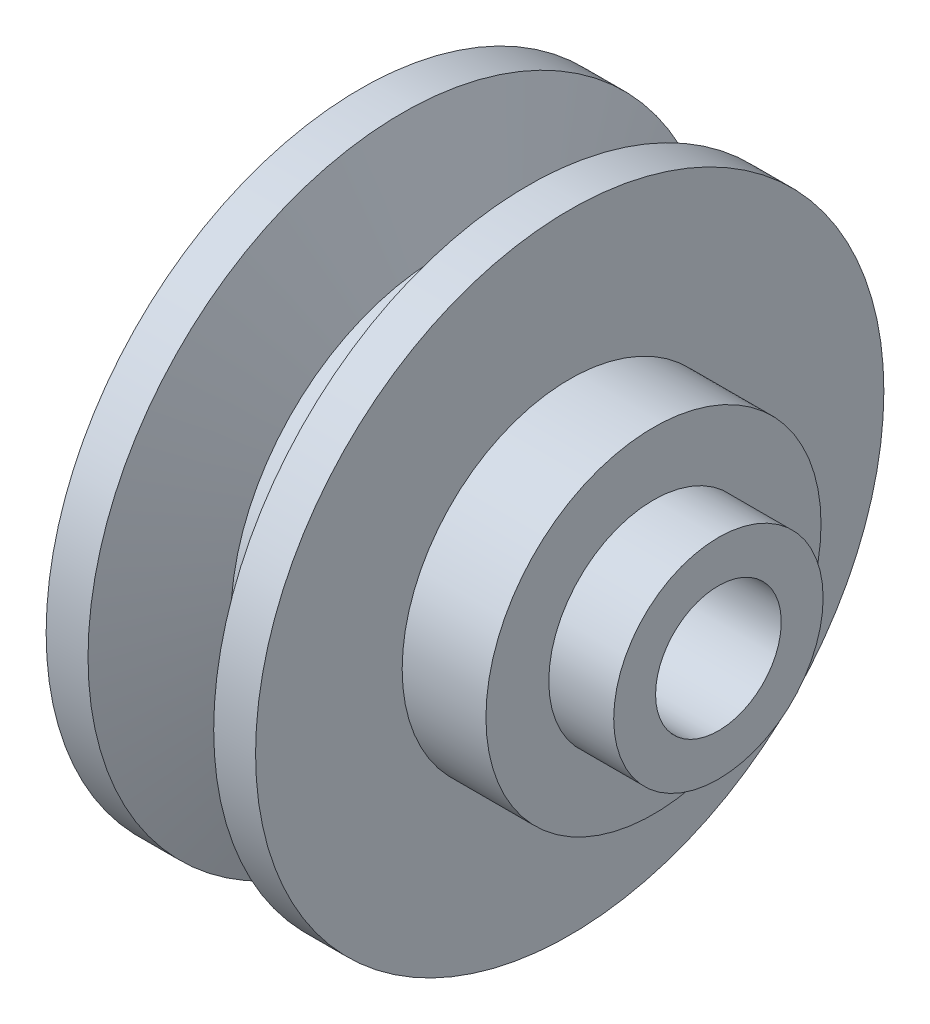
SolidWorks part; units mm, degrees
ref_plane "Front" through (0, 0, 0) normal (0, 0, 1) x (1, 0, 0)
ref_plane "Top" through (0, 0, 0) normal (0, 1, 0) x (1, 0, 0)
ref_plane "Right" through (0, 0, 0) normal (1, 0, 0) x (0, 0, -1)
sketch "Sketch1" plane through (0, 0, 0) normal (0, 1, 0) x (1, 0, 0)
  line L0 (0, 0) -> (17.1, 0)
  line L1 (17.1, 3) -> (17.1, 5)
  line L2 (17.1, 5) -> (14, 5)
  line L3 (14, 5) -> (14, 8)
  line L4 (14, 8) -> (10, 8)
  line L5 (10, 8) -> (10, 15)
  line L6 (10, 15) -> (8, 15)
  line L7 (0, 15) -> (0, 6.4)
  line L8 (2, 15) -> (0, 15)
  line L9 (3.4, 3) -> (17.1, 3)
  line L11 (3.4, 3) -> (0, 6.4)
  line L12 (2, 15) -> (3.8199, 10)
  line L13 (8, 15) -> (6.1801, 10)
  line L14 (3.8199, 10) -> (6.1801, 10)
  line L15 (0, 3) -> (17.1, 3) construction
revolve "Revolve1" add sketch "Sketch1" angle 360 about L0
